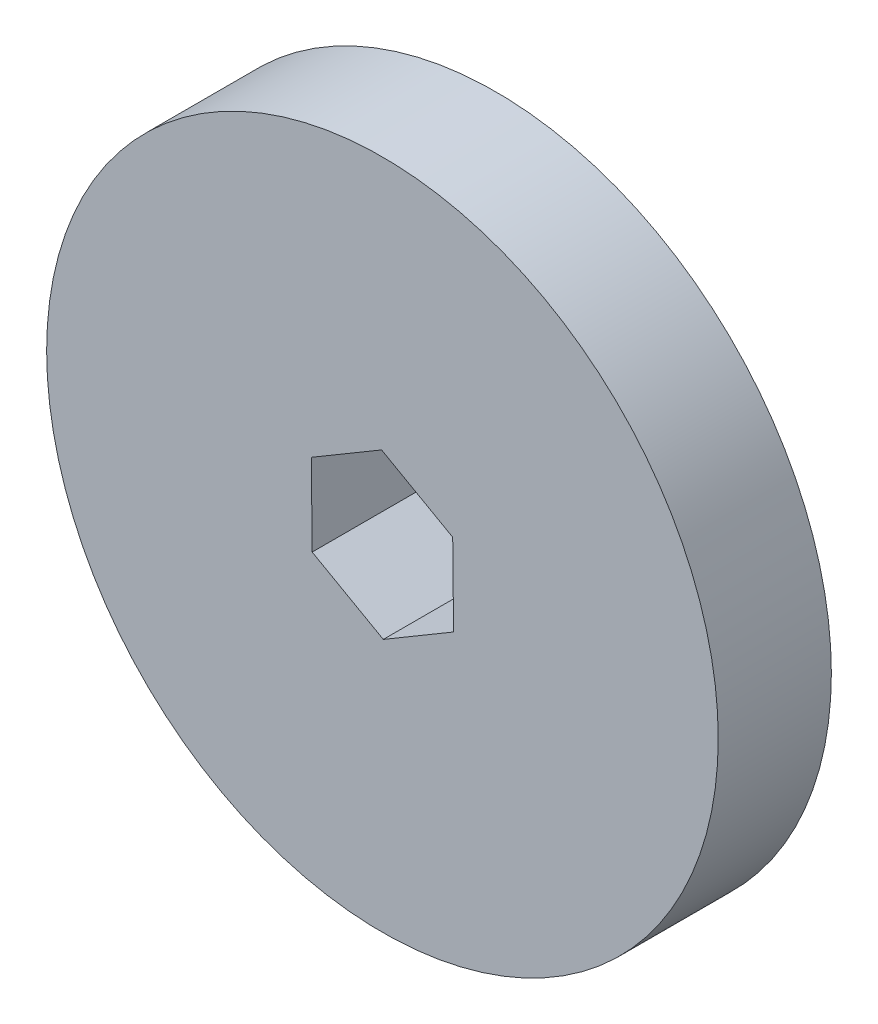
SolidWorks part; units mm, degrees
ref_plane "Front Plane" through (0, 0, 0) normal (0, 0, 1) x (1, 0, 0)
ref_plane "Top Plane" through (0, 0, 0) normal (0, 1, 0) x (1, 0, 0)
ref_plane "Right Plane" through (0, 0, 0) normal (1, 0, 0) x (0, 0, -1)
sketch "Sketch3" plane through (0, 0, 0) normal (0, 0, 1) x (1, 0, 0)
  circle A0 centre (0, 0) radius 30.1625
  point P0 (0, 0)
extrude "Boss-Extrude2" add sketch "Sketch3" along normal blind 10.16
sketch "Sketch5" plane through (0, 0, 10.16) normal (0, 0, 1) x (1, 0, 0)
  line L1 (6.311, 3.733) -> (-0.0774, 7.3319)
  line L2 (-0.0774, 7.3319) -> (-6.3883, 3.599)
  line L3 (-6.3883, 3.599) -> (-6.311, -3.733)
  line L4 (-6.311, -3.733) -> (0.0774, -7.3319)
  line L5 (0.0774, -7.3319) -> (6.3883, -3.599)
  line L6 (6.3883, -3.599) -> (6.311, 3.733)
  circle A0 centre (0, 0) radius 6.35 construction
extrude "Cut-Extrude1" cut sketch "Sketch5" against normal blind 10.16
